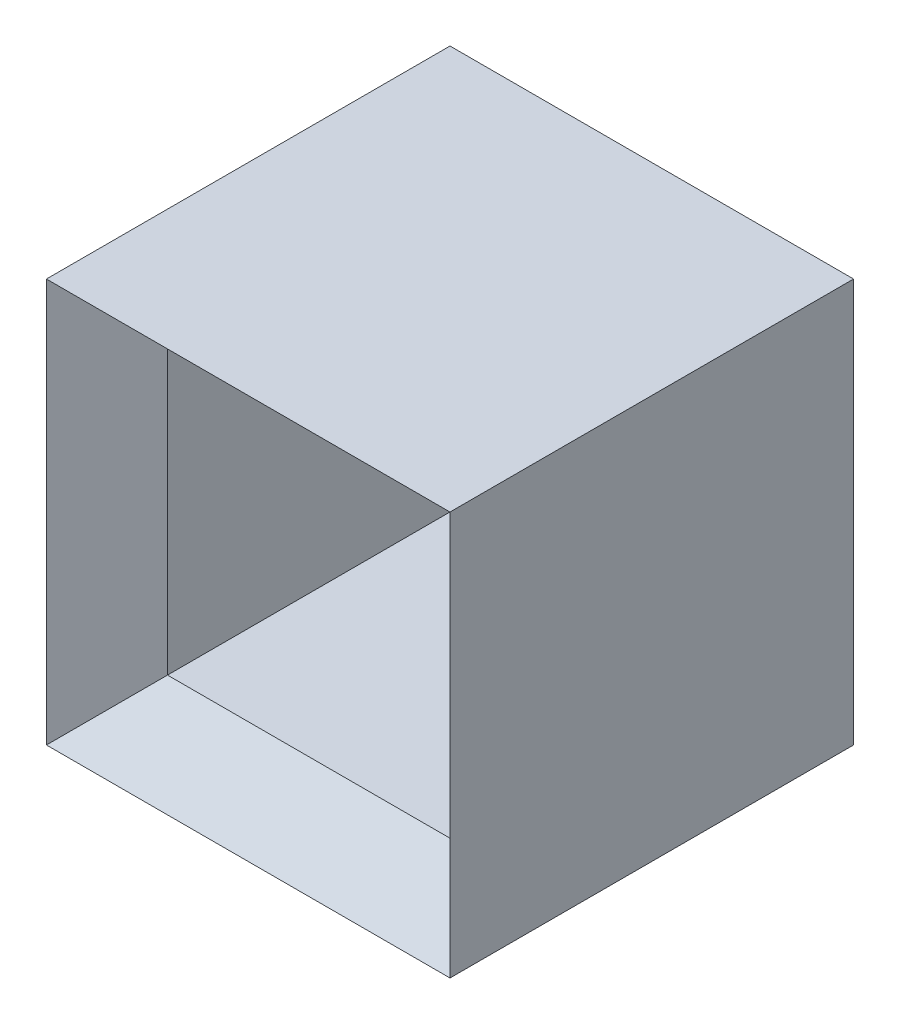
SolidWorks part; units mm, degrees
ref_plane "Plan de face" through (0, 0, 0) normal (0, 0, 1) x (1, 0, 0)
ref_plane "Plan de dessus" through (0, 0, 0) normal (0, 1, 0) x (1, 0, 0)
ref_plane "Plan de droite" through (0, 0, 0) normal (1, 0, 0) x (0, 0, -1)
sketch "Esquisse1" plane through (0, 0, 0) normal (0, 0, 1) x (1, 0, 0)
  line L1 (-51.8886, 45.1757) -> (48.1114, 45.1757)
  line L2 (-51.8886, 45.1757) -> (-51.8886, -54.8243)
  line L3 (-51.8886, -54.8243) -> (48.1114, -54.8243)
  line L4 (48.1114, 45.1757) -> (48.1114, -54.8243)
  dimension "D1" = 100
  dimension "D2" = 100
extrude "Extrusion1" add sketch "Esquisse1" along normal blind 100
sketch "Esquisse2" plane through (0, 0, 100) normal (0, 0, 1) x (1, 0, 0)
  line L0 (-51.8886, 45.1757) -> (-51.8886, -54.8243) construction
  line L1 (-36.8886, 30.1757) -> (33.1114, 30.1757)
  line L2 (-36.8886, 30.1757) -> (-36.8886, -39.8243)
  line L3 (-36.8886, -39.8243) -> (33.1114, -39.8243)
  line L4 (33.1114, 30.1757) -> (33.1114, -39.8243)
  line L5 (48.1114, 45.1757) -> (-51.8886, 45.1757) construction
  dimension "D1" = 70
  dimension "D2" = 70
  dimension "D3" = 15
  dimension "D4" = 15
extrude "Enlèv. mat.-Extru.1" cut sketch "Esquisse2" against normal through all
chamfer "Chanfrein1" distance 15 angle 45 4 edges at (33.1114, -4.8243, 100) (-1.8886, -39.8243, 100) (-36.8886, -4.8243, 100) (-1.8886, 30.1757, 100)
chamfer "Chanfrein2" distance 15 angle 45 4 edges at (33.1114, -4.8243, 0) (-1.8886, -39.8243, 0) (-36.8886, -4.8243, 0) (-1.8886, 30.1757, 0)
